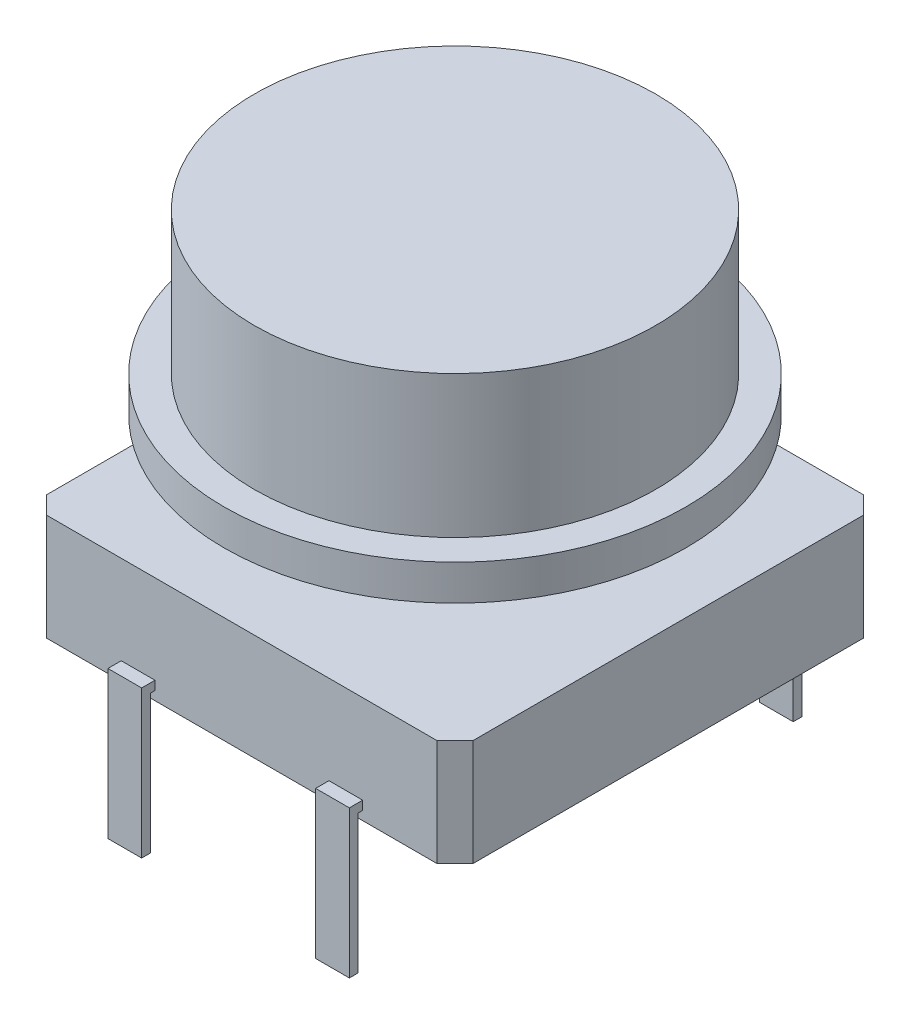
SolidWorks part; units mm, degrees
other "Markup1"
sketch "Sketch13" plane through (-6.5, 10.2, -6.5) normal (-0.9979, 0.0018, -0.0647) x (-0.0647, 0.0089, 0.9979)
ref_plane "Front Plane" through (0, 0, 0) normal (0, 0, 1) x (1, 0, 0)
ref_plane "Top Plane" through (0, 0, 0) normal (0, 1, 0) x (1, 0, 0)
ref_plane "Right Plane" through (0, 0, 0) normal (1, 0, 0) x (0, 0, -1)
sketch "Sketch1" plane through (0, 0, 0) normal (0, 1, 0) x (1, 0, 0)
  line L0 (-5.5, 6) -> (-6, 5.5)
  line L1 (-5.5, 6) -> (5.5, 6)
  line L2 (-6, 5.5) -> (-6, -5.5)
  line L3 (-5.5, -6) -> (5.5, -6)
  line L4 (6, 5.5) -> (6, -5.5)
  line L5 (-6, 6) -> (6, -6) construction
  line L6 (-6, -6) -> (6, 6) construction
  line L7 (5.5, 6) -> (6, 5.5)
  line L8 (5.5, -6) -> (6, -5.5)
  line L9 (-6, -5.5) -> (-5.5, -6)
  point P0 (0, 0)
  dimension "D1" = 12
  dimension "D2" = 12
extrude "Boss-Extrude1" add sketch "Sketch1" along normal blind 3
sketch "Sketch2" plane through (0, 3, 0) normal (0, 1, 0) x (1, 0, 0)
  circle A0 centre (0, 0) radius 3.375
  dimension "D1" = 6.75
extrude "Boss-Extrude2" add sketch "Sketch2" along normal blind 0.2
sketch "Sketch3" plane through (0, 3.2, 0) normal (0, 1, 0) x (1, 0, 0)
  line L1 (-1.75, 1.75) -> (1.75, 1.75)
  line L2 (-1.75, 1.75) -> (-1.75, -1.75)
  line L3 (-1.75, -1.75) -> (1.75, -1.75)
  line L4 (1.75, 1.75) -> (1.75, -1.75)
  line L5 (-1.75, 1.75) -> (1.75, -1.75) construction
  line L6 (-1.75, -1.75) -> (1.75, 1.75) construction
  point P0 (0, 0)
  dimension "D1" = 3.5
  dimension "D2" = 3.5
extrude "Boss-Extrude3" add sketch "Sketch3" along normal blind 2
sketch "Sketch4" plane through (0, 5.2, 0) normal (0, 1, 0) x (1, 0, 0)
  circle A0 centre (0, 0) radius 6.5
  dimension "D1" = 13
extrude "Boss-Extrude4" add sketch "Sketch4" along normal blind 1
sketch "Sketch5" plane through (0, 6.2, 0) normal (0, 1, 0) x (1, 0, 0)
  circle A0 centre (0, 0) radius 5.65
  dimension "D1" = 11.3
extrude "Boss-Extrude5" add sketch "Sketch5" along normal blind 4
ref_plane "Plane1" through (-3.4, 0, 0) normal (-1, 0, 0) x (0, 0, 1)
sketch "Sketch7" plane through (-3.4, 0, 0) normal (-1, 0, 0) x (0, 0, 1)
  line L1 (6, 3) -> (6, 0) construction
  line L7 (6.375, 0.5) -> (6, 0.5)
  line L9 (-5.5, 3) -> (5.5, 3) construction
  line L17 (0, -2.34) -> (0, 11.1182) construction
  line L18 (6, 0.5) -> (6, 0.25)
  line L23 (6.1875, 0.5) -> (6.1875, -2.75) construction
  line L24 (6, 0.25) -> (6.125, 0.25)
  line L28 (6.125, 0.25) -> (6.125, -3.65)
  line L29 (6.375, 0.5) -> (6.375, -3.65)
  line L30 (6.375, -3.65) -> (6.125, -3.65)
  dimension "D1" = 2.5
  dimension "D2" = 0.375
  dimension "D6" = 0.25
extrude "Boss-Extrude6" add sketch "Sketch7" against normal blind 0.95
ref_plane "Plane2" through (0, 0, 0) normal (-1, 0, 0) x (0, 0, 1)
mirror "Mirror1" about plane through (0, 0, 0) normal (-1, 0, 0) of "Boss-Extrude6"
ref_plane "Plane3" through (0, 0, 0) normal (0, 0, 1) x (1, 0, 0)
mirror "Mirror2" about plane through (0, 0, 0) normal (0, 0, 1) of "Mirror1", "Boss-Extrude6"
